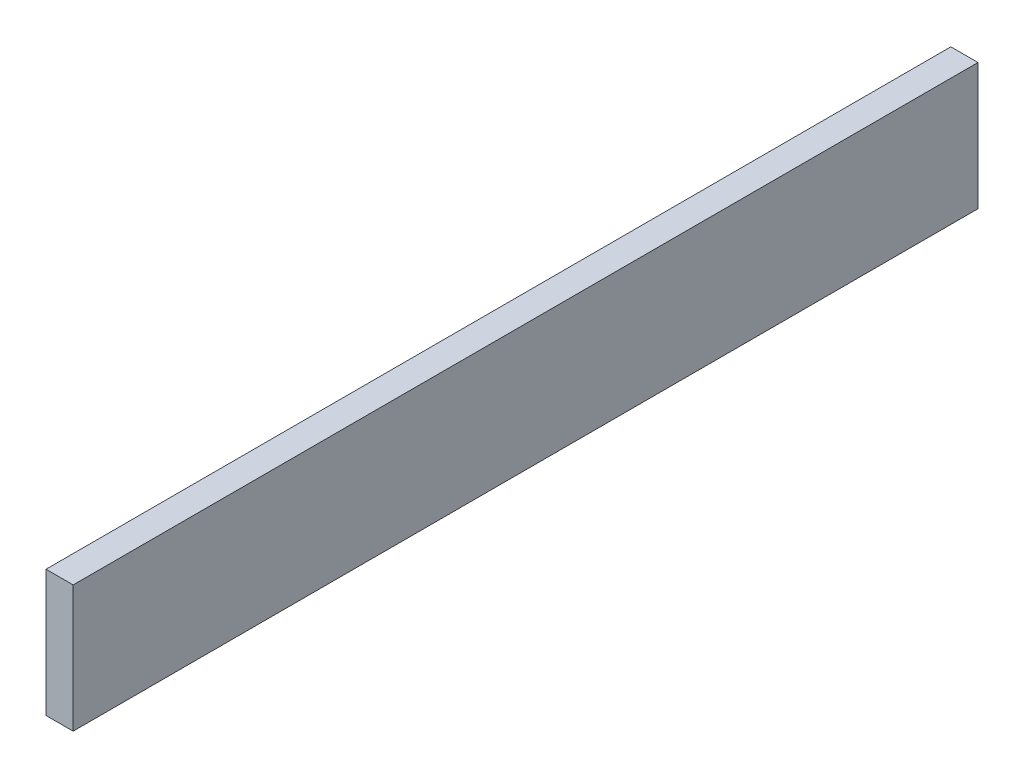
SolidWorks part; units mm, degrees
ref_plane "Front Plane" through (0, 0, 0) normal (0, 0, 1) x (1, 0, 0)
ref_plane "Top Plane" through (0, 0, 0) normal (0, 1, 0) x (1, 0, 0)
ref_plane "Right Plane" through (0, 0, 0) normal (1, 0, 0) x (0, 0, -1)
sketch "Sketch1" plane through (0, 0, 0) normal (0, 0, 1) x (1, 0, 0)
  line L1 (-9.525, 44.45) -> (9.525, 44.45)
  line L2 (-9.525, 44.45) -> (-9.525, -44.45)
  line L3 (-9.525, -44.45) -> (9.525, -44.45)
  line L4 (9.525, 44.45) -> (9.525, -44.45)
  line L5 (-9.525, 44.45) -> (9.525, -44.45) construction
  line L6 (-9.525, -44.45) -> (9.525, 44.45) construction
  point P0 (0, 0)
  dimension "D1" = 19.05
  dimension "D2" = 88.9
extrude "Boss-Extrude1" add sketch "Sketch1" along normal blind 635
